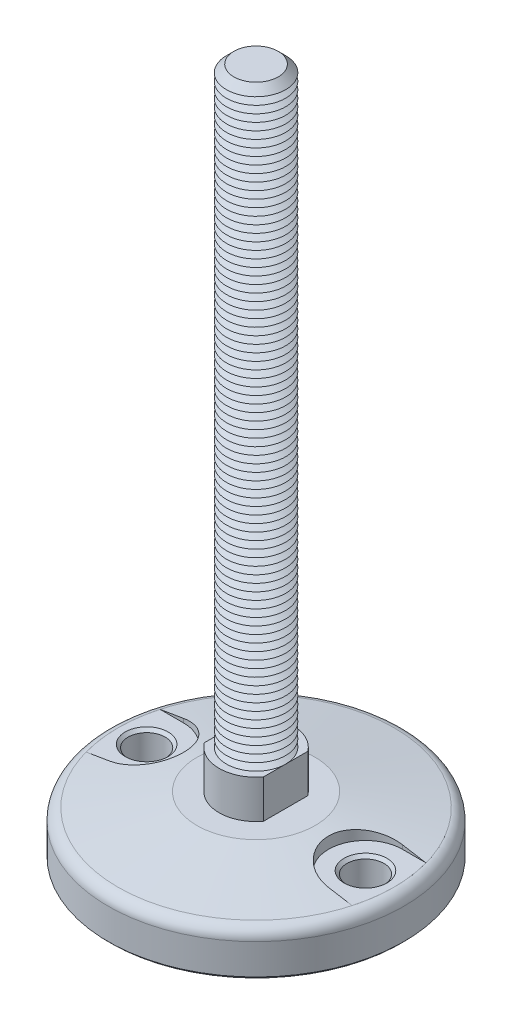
SolidWorks part; units mm, degrees
ref_plane "Front Plane" through (0, 0, 0) normal (0, 0, 1) x (1, 0, 0)
ref_plane "Top Plane" through (0, 0, 0) normal (0, 1, 0) x (1, 0, 0)
ref_plane "Right Plane" through (0, 0, 0) normal (1, 0, 0) x (0, 0, -1)
sketch "Sketch1" plane through (0, 0, 0) normal (1, 0, 0) x (0, 0, -1)
  line L0 (0, 61.3389) -> (0, -58.404) construction
sketch "Sketch2" plane through (0, 0, 0) normal (1, 0, 0) x (0, 0, -1)
  line L0 (0, 0) -> (-20, 0)
  line L1 (-20, 0) -> (-50, -5.2898)
  line L2 (-50, -5.2898) -> (-50, -20)
  line L3 (-50, -20) -> (0, -20)
  line L4 (0, 61.3389) -> (0, -58.404) construction
  line L5 (0, -20) -> (0, 0)
  dimension "D1" = 20
  dimension "D2" = 50
  dimension "D3" = 20
  dimension "D4" = 10
revolve "Revolve1" add sketch "Sketch2" angle 360 about L0
fillet "Fillet1" radius 4 1 edges at (0, -5.2898, 50)
sketch "Sketch3" plane through (0, 0, 0) normal (0, 1, 0) x (1, 0, 0)
  circle A0 centre (0, 0) radius 12.5
  dimension "D1" = 25
extrude "Boss-Extrude1" add sketch "Sketch3" along normal blind 13
sketch "Sketch4" plane through (0, 13, 0) normal (0, 1, 0) x (1, 0, 0)
  line L0 (-10, 7.5) -> (-10, -7.5)
  line L2 (10, -7.5) -> (10, 7.5)
  arc A0 (-10, 7.5) -> (-10, -7.5) centre (0, 0) ccw
  circle A1 centre (0, 0) radius 12.5 construction
  arc A2 (10, -7.5) -> (10, 7.5) centre (0, 0) ccw
  dimension "D1" = 20
extrude "Cut-Extrude1" cut sketch "Sketch4" against normal blind 13
sketch "Sketch5" plane through (0, 13, 0) normal (0, 1, 0) x (1, 0, 0)
  circle A0 centre (0, 0) radius 10
  dimension "D1" = 20
extrude "Boss-Extrude2" add sketch "Sketch5" along normal blind 200
chamfer "Chamfer1" distance 2.5 angle 45 1 edges at (0, 213, 10)
sketch "Sketch6" plane through (0, 0, 0) normal (1, 0, 0) x (0, 0, -1)
  line L0 (-10, 13) -> (-7.8349, 14.25)
  line L1 (-7.8349, 14.25) -> (-10, 15.5)
  line L2 (-10, 210.5) -> (-10, 13) construction
  line L3 (-10, 15.5) -> (-10, 13)
  dimension "D1" = 2.5
revolve "Cut-Revolve1" cut sketch "Sketch6" angle 360 about L0
pattern_linear "LPattern1" count 79 spacing 2.5 along (0, 1, 0) of "Cut-Revolve1"
sketch "Sketch8" plane through (0, 0, 0) normal (0, 1, 0) x (1, 0, 0)
  line L0 (-37, 12.5) -> (-44.9904, 12.5)
  line L1 (-37, -12.5) -> (-44.9904, -12.5)
  arc A1 (-44.9904, 12.5) -> (-44.9904, -12.5) centre (0, 0) ccw
  circle A2 centre (0, 0) radius 46.6946 construction
  arc A3 (-37, -12.5) -> (-37, 12.5) centre (-37, 0) ccw
  point P3 (-37, 0)
  point P11 (0, 0)
  dimension "D1" = 37
  dimension "D2" = 25
extrude "Cut-Extrude4" cut sketch "Sketch8" against normal blind 4.7
sketch "Sketch10" plane through (0, -4.7, 0) normal (0, 1, 0) x (1, 0, 0)
  circle A0 centre (-37, 0) radius 6.25
  dimension "D1" = 12.5
extrude "Cut-Extrude5" cut sketch "Sketch10" against normal up to surface (15.3 mm away)
chamfer "Chamfer2" distance 1 angle 45 2 edges at (-37, -20, -6.25) (-37, -4.7, 6.25)
mirror "Mirror1" about plane through (0, 0, 0) normal (1, 0, 0) of "Chamfer2", "Cut-Extrude5", "Cut-Extrude4"
chamfer "Chamfer3" distance 1 angle 45 1 edges at (0, -20, 50)
